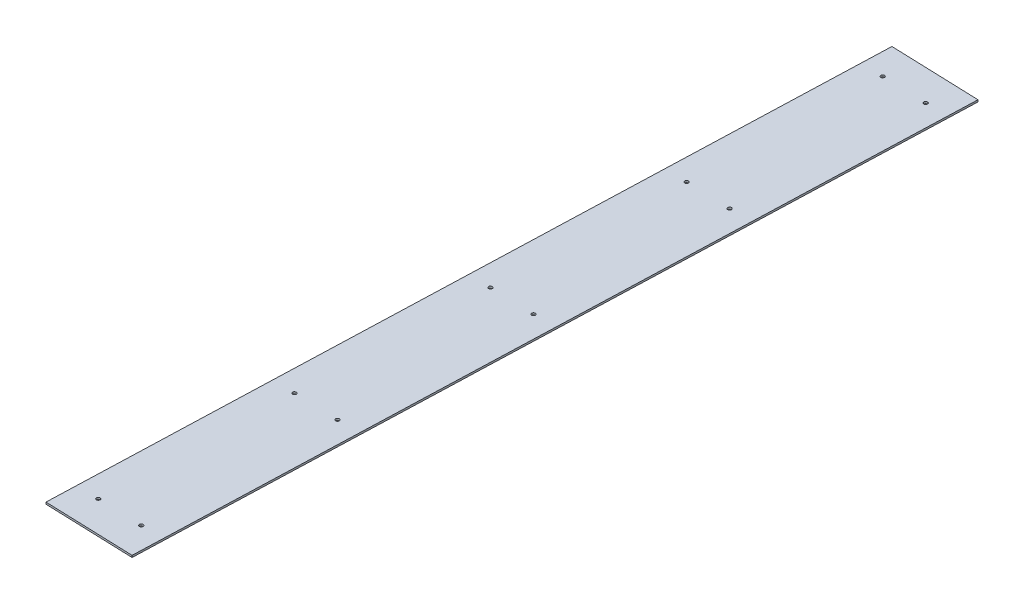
SolidWorks part; units mm, degrees
ref_plane "Front Plane" through (0, 0, 0) normal (0, 0, 1) x (1, 0, 0)
ref_plane "Top Plane" through (0, 0, 0) normal (0, 1, 0) x (1, 0, 0)
ref_plane "Right Plane" through (0, 0, 0) normal (1, 0, 0) x (0, 0, -1)
sketch "Sketch1" plane through (0, -1.6256, 0) normal (0, -1, 0) x (1, 0, 0)
  line L0 (-784.6306, -515.4929) -> (-753.3855, -1414.3767) construction
  line L1 (-784.6306, -515.4929) -> (-753.3855, -1414.3767) construction
  line L2 (-807.0851, -966.2584) -> (-730.9311, -963.6113) construction
  line L3 (-794.9525, -1315.2976) -> (-819.2177, -617.2192)
  line L4 (-718.7985, -1312.6505) -> (-743.0636, -614.5721)
  line L5 (-819.2177, -617.2192) -> (-743.0636, -614.5721)
  line L6 (-718.7985, -1312.6505) -> (-794.9525, -1315.2976)
  line L7 (-800.1791, -616.5574) -> (-799.2968, -641.9421) construction
  line L8 (-799.2968, -641.9421) -> (-793.6717, -803.7693) construction
  circle A0 centre (-799.2968, -641.9421) radius 1.5875
  circle A1 centre (-793.6717, -803.7693) radius 1.5875
  circle A2 centre (-788.0466, -965.5966) radius 1.5875
  circle A3 centre (-782.4215, -1127.4239) radius 1.5875
  circle A4 centre (-776.7964, -1289.2511) radius 1.5875
  circle A5 centre (-761.2198, -640.6185) radius 1.5875
  circle A6 centre (-755.5947, -802.4458) radius 1.5875
  circle A7 centre (-749.9696, -964.273) radius 1.5875
  circle A8 centre (-744.3445, -1126.1003) radius 1.5875
  circle A9 centre (-738.7194, -1287.9276) radius 1.5875
  point P5 (-769.0081, -964.9348)
  point P8 (-807.0851, -966.2584)
  point P11 (-730.9311, -963.6113)
  dimension "D6" = 3.175
  dimension "D7" = 5
  dimension "D1" = 76.2
  dimension "D2" = 180
  dimension "D3" = 698.5
  dimension "D4" = 19.05
  dimension "D5" = 25.4
  dimension "D8" = 161.925
extrude "Boss-Extrude1" add sketch "Sketch1" along normal blind 1.6256
